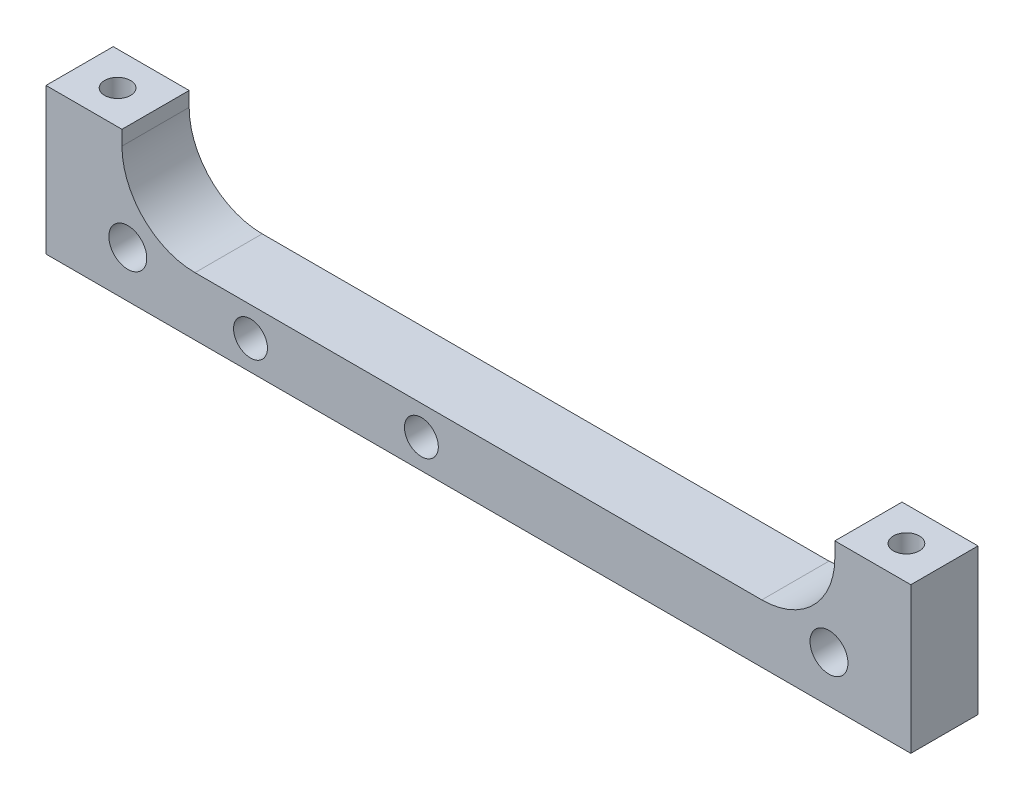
SolidWorks part; units mm, degrees
ref_plane "Front" through (0, 0, 0) normal (0, 0, 1) x (1, 0, 0)
ref_plane "Top" through (0, 0, 0) normal (0, 1, 0) x (1, 0, 0)
ref_plane "Right" through (0, 0, 0) normal (1, 0, 0) x (0, 0, -1)
sketch "Sketch1" plane through (0, 0, 0) normal (0, 0, 1) x (1, 0, 0)
  line L1 (0, 0) -> (75.184, 0)
  line L2 (0, 0) -> (0, -12.7)
  line L3 (0, -12.7) -> (75.184, -12.7)
  line L4 (75.184, 0) -> (75.184, -12.7)
  dimension "D1" = 75.184
  dimension "D2" = 12.7
extrude "Extrude1" add sketch "Sketch1" along normal blind 5.842
sketch "Sketch2" plane through (0, 0, 5.842) normal (0, 0, 1) x (1, 0, 0)
  line L0 (75.184, 0) -> (0, 0) construction
  line L1 (6.604, 0) -> (68.58, 0)
  line L2 (6.604, 0) -> (6.604, -7.62)
  line L3 (6.604, -7.62) -> (68.58, -7.62)
  line L4 (68.58, 0) -> (68.58, -7.62)
  line L5 (0, 0) -> (0, -12.7) construction
  line L6 (75.184, -12.7) -> (75.184, 0) construction
  dimension "D1" = 6.604
  dimension "D2" = 6.604
  dimension "D3" = 7.62
extrude "Cut-Extrude1" cut sketch "Sketch2" against normal through all
chamfer "Chamfer1" [suppressed] distance 8.89 angle 45
chamfer "Chamfer2" [suppressed] distance 8.89 angle 45
hole_wizard "#4-40 Tapped Hole1" positions "Sketch4" profile "Sketch3" tap size "#4-40" standard "Ansi Inch"
sketch "Sketch4" plane through (0, 0, 0) normal (0, 1, 0) x (-1, 0, 0)
  line L0 (-3.302, 5.842) -> (-3.302, 0) construction
  line L1 (-6.604, 5.842) -> (0, 5.842) construction
  line L2 (-6.604, 0) -> (0, 0) construction
  point P0 (-3.302, 2.921)
  point P1 (-71.882, 2.921)
  dimension "D1" = 3.302
  dimension "D2" = 68.58
sketch "Sketch3" plane through (3.302, 0, 2.921) normal (1, 0, 0) x (0, 0, 1)
  line L0 (0, 0) -> (0, 12.7)
  line L1 (0, 12.7) -> (1.1303, 12.7)
  line L2 (1.1303, 12.7) -> (1.1303, 0)
  line L5 (1.1303, 0) -> (0, 0)
  line L11 (0, -6.35) -> (0, 107.95) construction
  dimension "Thru Tap Drill Dia." = 2.2606
  dimension "Thru Tap Drill Depth" = 12.7
fillet "Fillet1" radius 6.35 2 edges at (6.604, -7.62, 2.921) (68.58, -7.62, 2.921)
hole_wizard "#32 (0.116) Diameter Hole1" positions "Sketch6" profile "Sketch5" hole size "#32" standard "Ansi Inch"
sketch "Sketch6" plane through (-32.127, 0.7043, 0) normal (0, 0, 1) x (1, 0, 0)
  line L0 (32.127, -15.9443) -> (107.311, -15.9443) construction
  line L1 (107.311, -15.9443) -> (107.311, -0.7043) construction
  line L2 (32.127, -0.7043) -> (32.127, -15.9443) construction
  point P0 (99.183, -12.3883)
  point P1 (40.255, -12.3883)
  dimension "D1" = 3.556
  dimension "D2" = 8.128
  dimension "D3" = 8.128
sketch "Sketch5" plane through (67.056, -11.684, 0) normal (1, 0, 0) x (0, 1, 0)
  line L0 (0, 0) -> (0, 5.842)
  line L1 (0, 5.842) -> (1.4732, 5.842)
  line L2 (1.4732, 5.842) -> (1.4732, 0)
  line L5 (1.4732, 0) -> (0, 0)
  line L11 (0, -6.35) -> (0, 107.95) construction
  dimension "Thru Hole Dia." = 2.9464
  dimension "Thru Hole Depth" = 5.842
hole_wizard "#4-40 Tapped Hole2" positions "Sketch8" profile "Sketch7" tap size "#4-40" standard "Ansi Inch"
sketch "Sketch8" plane through (75.184, 0, 0) normal (1, 0, 0) x (0, 0, -1)
  line L0 (-5.842, -12.7) -> (0, -6.858) construction
  line L1 (0, -12.7) -> (0, 0) construction
  line L2 (-5.842, -12.7) -> (0, -12.7) construction
  point P0 (-2.921, -9.779)
  dimension "D1" = 45
sketch "Sketch7" plane through (75.184, -9.779, 2.921) normal (0, 1, 0) x (0, 0, -1)
  line L0 (0, 0) -> (0, 9.1882)
  line L1 (0, 9.1882) -> (1.1303, 8.509)
  line L2 (1.1303, 8.509) -> (1.1303, 0)
  line L5 (1.1303, 0) -> (0, 0)
  line L10 (0, 9.1882) -> (-1.1303, 8.509) construction
  line L11 (0, -6.35) -> (0, 107.95) construction
  dimension "Tap Drill Dia." = 2.2606
  dimension "Tap Drill Depth" = 8.509
  dimension "Drill Angle" = 118
hole_wizard "#4-40 Tapped Hole3" positions "Sketch10" profile "Sketch9" tap size "#4-40" standard "Ansi Inch"
sketch "Sketch10" plane through (0, 0, 0) normal (0, 1, 0) x (-1, 0, 0)
  line L0 (0, 5.842) -> (0, 0) construction
  line L1 (-3.302, 5.842) -> (-3.302, 0) construction
  line L2 (-6.604, 5.842) -> (0, 5.842) construction
  line L3 (-6.604, 0) -> (0, 0) construction
  point P0 (-3.302, 2.921)
  point P1 (-71.882, 2.921)
  point P4 (0, 2.921)
  point P14 (-3.302, 2.921)
  dimension "D1" = 3.302
  dimension "D2" = 68.58
sketch "Sketch9" plane through (3.302, 0, 2.921) normal (1, 0, 0) x (0, 0, 1)
  line L0 (0, 0) -> (0, 9.1882)
  line L1 (0, 9.1882) -> (1.1303, 8.509)
  line L2 (1.1303, 8.509) -> (1.1303, 0)
  line L5 (1.1303, 0) -> (0, 0)
  line L10 (0, 9.1882) -> (-1.1303, 8.509) construction
  line L11 (0, -6.35) -> (0, 107.95) construction
  dimension "Tap Drill Dia." = 2.2606
  dimension "Tap Drill Depth" = 8.509
  dimension "Drill Angle" = 118
hole_wizard "M3.1 (3.1) Diameter Hole1" positions "Sketch12" profile "Sketch11" hole size "M3.1" standard "Ansi Metric"
sketch "Sketch12" plane through (0, 0, 0) normal (0, 0, -1) x (-1, 0, 0)
  line L0 (0, 0) -> (0, -12.7) construction
  line L1 (-75.184, -12.7) -> (-75.184, 0) construction
  line L2 (0, -12.7) -> (-75.184, -12.7) construction
  point P0 (-7.366, -9.525)
  point P1 (-67.818, -9.525)
  dimension "D1" = 7.366
  dimension "D2" = 7.366
  dimension "D3" = 3.175
sketch "Sketch11" plane through (7.366, -9.525, 0) normal (1, 0, 0) x (0, 1, 0)
  line L0 (0, 0) -> (0, 5.842)
  line L1 (0, 5.842) -> (1.55, 5.842)
  line L2 (1.55, 5.842) -> (1.55, 0)
  line L5 (1.55, 0) -> (0, 0)
  line L11 (0, -6.35) -> (0, 107.95) construction
  dimension "Thru Hole Dia." = 3.1
  dimension "Thru Hole Depth" = 5.842
hole_wizard "#32 (0.116) Diameter Hole2" positions "Sketch14" profile "Sketch13" hole size "#32" standard "Ansi Inch"
sketch "Sketch14" plane through (0, 0, 0) normal (0, 0, -1) x (-1, 0, 0)
  line L0 (-32.6334, -7.62) -> (-32.6334, -12.7) construction
  line L1 (-12.954, -7.62) -> (-62.23, -7.62) construction
  line L2 (0, -12.7) -> (-75.184, -12.7) construction
  line L4 (0, 0) -> (0, -12.7) construction
  point P0 (-32.6334, -10.16)
  point P1 (-17.78, -10.16)
  dimension "D1" = 14.8534
  dimension "D2" = 17.78
sketch "Sketch13" plane through (32.6334, -10.16, 0) normal (1, 0, 0) x (0, 1, 0)
  line L0 (0, 0) -> (0, 5.842)
  line L1 (0, 5.842) -> (1.4732, 5.842)
  line L2 (1.4732, 5.842) -> (1.4732, 0)
  line L5 (1.4732, 0) -> (0, 0)
  line L11 (0, -6.35) -> (0, 107.95) construction
  dimension "Thru Hole Dia." = 2.9464
  dimension "Thru Hole Depth" = 5.842
hole_wizard "M4.1 (4.1) Diameter Hole1" positions "3DSketch1" profile "Sketch17" hole size "M4.1" standard "Ansi Metric"
sketch3d "3DSketch1"
  line L2 (0, -12.7, 5.842) -> (75.184, -12.7, 5.842) construction
  line L3 (75.184, -12.7, 0) -> (75.184, 0, 0) construction
  line L5 (0, 0, 0) -> (0, -12.7, 0) construction
  point P0 (7.112, -8.6439, 0)
  point P31 (68.072, -8.6439, 0)
  dimension "D1" = 7.112
  dimension "D2" = 7.112
  dimension "D3" = 7.112
sketch "Sketch17" plane through (7.112, -8.6439, 0) normal (1, 0, 0) x (0, 1, 0)
  line L0 (0, 0) -> (0, 5.842)
  line L1 (0, 5.842) -> (2.05, 5.842)
  line L2 (2.05, 5.842) -> (2.05, 0)
  line L5 (2.05, 0) -> (0, 0)
  line L11 (0, -6.35) -> (0, 107.95) construction
  dimension "Thru Hole Dia." = 4.1
  dimension "Thru Hole Depth" = 5.842
hole_wizard "M4x0.7 Tapped Hole1" positions "Sketch19" profile "Sketch18" tap size "M4x0.7" standard "Ansi Metric"
sketch "Sketch19" plane through (0, 0, 0) normal (0, 0, -1) x (-1, 0, 0)
  point P0 (-68.072, -8.6439)
  point P1 (-7.112, -8.6439)
sketch "Sketch18" plane through (68.072, -8.6439, 0) normal (1, 0, 0) x (0, 1, 0)
  line L0 (0, 0) -> (0, 5.842)
  line L1 (0, 5.842) -> (1.65, 5.842)
  line L2 (1.65, 5.842) -> (1.65, 0)
  line L5 (1.65, 0) -> (0, 0)
  line L11 (0, -6.35) -> (0, 107.95) construction
  dimension "Thru Tap Drill Dia." = 3.3
  dimension "Thru Tap Drill Depth" = 5.842
